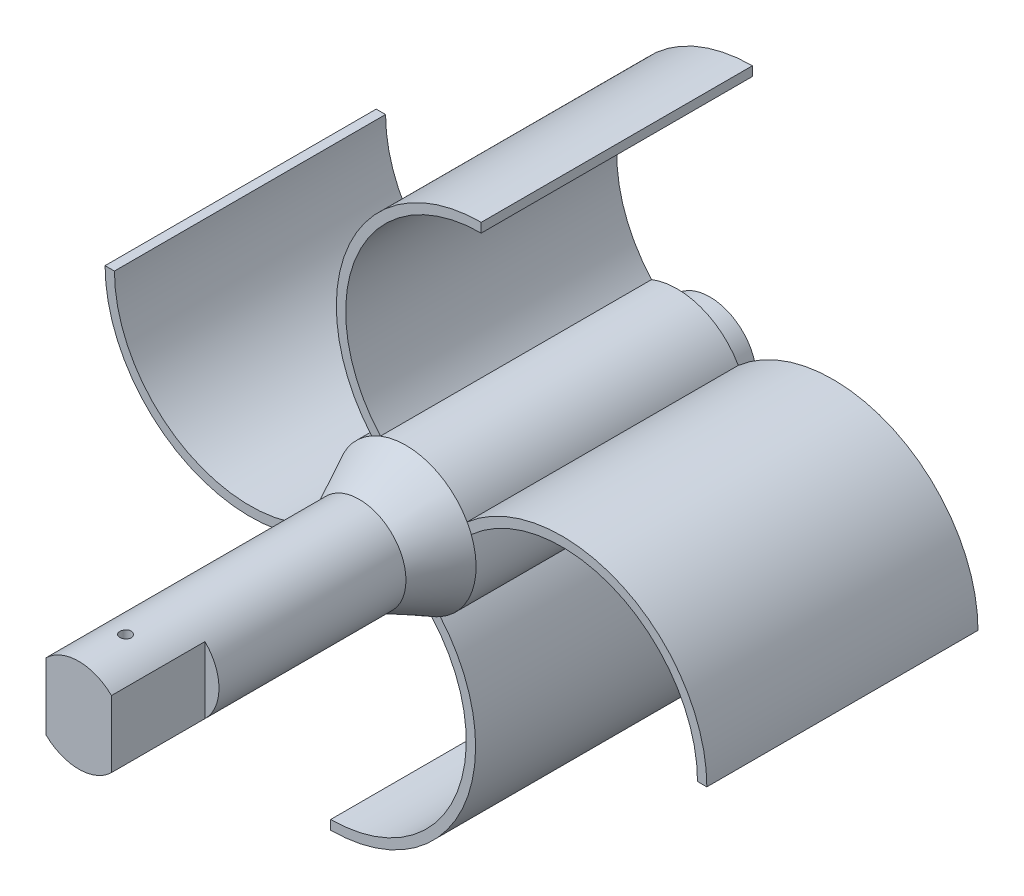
SolidWorks part; units mm, degrees
ref_plane "Plan de face" through (0, 0, 0) normal (0, 0, 1) x (1, 0, 0)
ref_plane "Plan de dessus" through (0, 0, 0) normal (0, 1, 0) x (1, 0, 0)
ref_plane "Plan de droite" through (0, 0, 0) normal (1, 0, 0) x (0, 0, -1)
sketch "Esquisse2" plane through (0, 0, 0) normal (0, 0, 1) x (1, 0, 0)
  line L1 (-64.3633, 16.1026) -> (-62.3633, 16.1026)
  line L2 (16.1026, 64.3633) -> (16.1026, 62.3633)
  line L5 (64.3633, -16.1026) -> (62.3633, -16.1026)
  line L6 (-16.1026, -64.3633) -> (-16.1026, -62.3633)
  arc A1 (-62.3633, 16.1026) -> (-13.9711, -5.4598) centre (-33.3633, 16.1026) ccw
  arc A3 (-13.0807, -7.3413) -> (5.4598, -13.9711) centre (0, 0) ccw
  arc A4 (-64.3633, 16.1026) -> (-13.0807, -7.3413) centre (-33.3633, 16.1026) ccw
  arc A5 (16.1026, 62.3633) -> (-5.4598, 13.9711) centre (16.1026, 33.3633) ccw
  arc A6 (16.1026, 64.3633) -> (-7.3413, 13.0807) centre (16.1026, 33.3633) ccw
  arc A7 (62.3633, -16.1026) -> (13.9711, 5.4598) centre (33.3633, -16.1026) ccw
  arc A8 (64.3633, -16.1026) -> (13.0807, 7.3413) centre (33.3633, -16.1026) ccw
  arc A9 (-16.1026, -62.3633) -> (5.4598, -13.9711) centre (-16.1026, -33.3633) ccw
  arc A10 (-16.1026, -64.3633) -> (7.3413, -13.0807) centre (-16.1026, -33.3633) ccw
  arc A13 (-7.3413, 13.0807) -> (-13.9711, -5.4598) centre (0, 0) ccw
  arc A16 (13.0807, 7.3413) -> (-5.4598, 13.9711) centre (0, 0) ccw
  arc A19 (7.3413, -13.0807) -> (13.9711, 5.4598) centre (0, 0) ccw
  arc A20 (-64.3633, 16.1026) -> (-12.6337, -6.9469) centre (-33.3633, 16.1026) ccw construction
  dimension "D1" = 15
  dimension "D3" = 2
  dimension "D2" = 31
extrude "Extrusion1" add sketch "Esquisse2" along normal blind 58
sketch "Esquisse4" plane through (0, 0, 0) normal (0, 0, -1) x (-1, 0, 0)
  circle A0 centre (0, 0) radius 10
  arc A1 (5.4598, 13.9711) -> (-13.0807, 7.3413) centre (0, 0) ccw construction
  dimension "D1" = 20
extrude "Extrusion3" add sketch "Esquisse4" along normal blind 7
ref_plane "Plan1" through (0, 0, 68) normal (0, 0, 1) x (1, 0, 0)
sketch "Esquisse6" plane through (0, 0, 68) normal (0, 0, 1) x (1, 0, 0)
  circle A0 centre (0, 0) radius 10
  dimension "D1" = 20
sketch "Esquisse7" plane through (0, 0, 58) normal (0, 0, 1) x (1, 0, 0)
  circle A0 centre (0, 0) radius 15
loft "Lissage1" add profiles "Esquisse7", "Esquisse6"
sketch "Esquisse8" plane through (0, 0, 68) normal (0, 0, 1) x (1, 0, 0)
  circle A0 centre (0, 0) radius 10
  dimension "D1" = 20
extrude "Extrusion4" add sketch "Esquisse8" along normal blind 60
sketch "Esquisse9" plane through (0, 0, 128) normal (0, 0, 1) x (1, 0, 0)
  line L0 (-7, 12.5295) -> (-7, -10.7657)
  line L1 (-7, -10.7657) -> (7, -10.7657)
  line L2 (7, -10.7657) -> (7, 12.5295)
  line L3 (7, 12.5295) -> (-7, 12.5295)
  circle A0 centre (0, 0) radius 10 construction
  dimension "D1" = 7
  dimension "D2" = 7
extrude "Enlèv. mat.-Extru.1" cut sketch "Esquisse9" against normal blind 20 flip side to cut
ref_plane "Plan2" through (0, 10, 0) normal (0, 1, 0) x (-1, 0, 0)
hole_wizard "Dégagement M21" positions "Esquisse11" profile "Esquisse10" hole size "M2" standard "ISO"
sketch "Esquisse11" plane through (0, 10, 0) normal (0, 1, 0) x (-1, 0, 0)
  line L0 (7, 128) -> (-7, 128) construction
  point P0 (0, 118)
  dimension "D1" = 10
sketch "Esquisse10" plane through (0, 10, 118) normal (1, 0, 0) x (0, 0, 1)
  line L0 (0, 0) -> (0, 74.3634)
  line L1 (0, 74.3634) -> (1.2, 74.3634)
  line L2 (1.2, 74.3634) -> (1.2, 0)
  line L5 (1.2, 0) -> (0, 0)
  line L11 (0, -6.35) -> (0, 107.95) construction
  dimension "Diamètre du perçage jusqu'au prochain" = 2.4
  dimension "Profondeur du perçage jusqu'au prochain" = 74.3634
